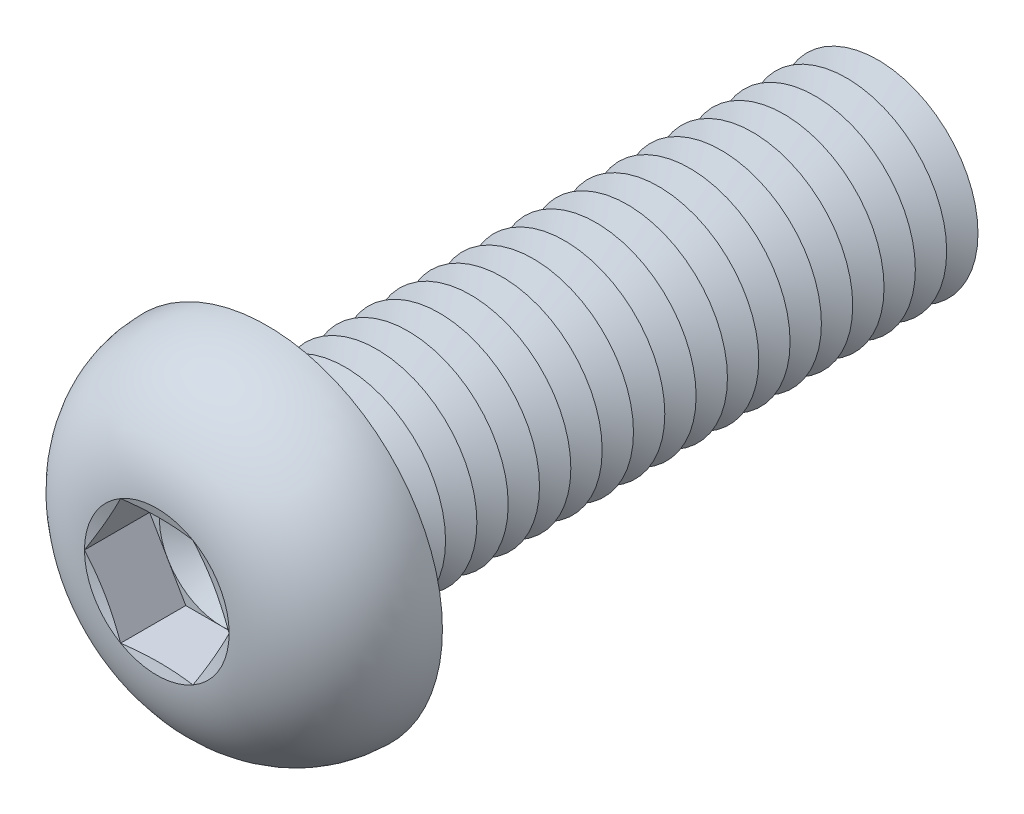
SolidWorks part; units mm, degrees
ref_plane "Front Plane" through (0, 0, 0) normal (0, 0, 1) x (1, 0, 0)
ref_plane "Top Plane" through (0, 0, 0) normal (0, 1, 0) x (1, 0, 0)
ref_plane "Right Plane" through (0, 0, 0) normal (1, 0, 0) x (0, 0, -1)
sketch "Sketch1" plane through (0, 0, 0) normal (1, 0, 0) x (0, 0, -1)
  line L0 (0, 4) -> (0, 7)
  line L3 (0, 4) -> (25, 4)
  line L4 (25, 4) -> (25, 0)
  line L5 (25, 0) -> (-4.4, 0) construction
  line L6 (-4.4, 0) -> (25, 0)
  line L7 (-4.4, 2.8867) -> (-4.4, 1.4434) construction
  line L8 (-4.4, 1.4434) -> (-4.4, 0)
  line L9 (-4.4, 2.8867) -> (-4.0132, 1.4434)
  line L10 (-4.0132, 1.4434) -> (-4.4, 1.4434)
  line L11 (25, 0) -> (22.7481, 0) construction
  line L12 (0, 7) -> (-4.4, 7) construction
  arc A1 (0, 7) -> (-4.4, 2.8867) centre (0, 2.59) ccw
  point P8 (25, 2)
  dimension "D1" = 14
  dimension "D2" = 8
  dimension "D3" = 4.4
  dimension "D4" = 5.7735
  dimension "D5" = 25
  dimension "D6" = 15
revolve "Revolve1" add sketch "Sketch1" angle 360 about L5
fillet "Fillet1" radius 0.625 1 edges at (-4, 0, 0)
sketch "Sketch2" plane through (0, 0, 0) normal (1, 0, 0) x (0, 0, -1)
  line L0 (24.375, 4) -> (25.625, 4)
  line L1 (25, 4) -> (0.625, 4) construction
  line L2 (25.625, 4) -> (25, 2.9175)
  line L3 (25, -4) -> (25, 4) construction
  line L4 (25, 2.9175) -> (24.375, 4)
  dimension "D1" = 1.25
revolve "Cut-Revolve1" cut sketch "Sketch2" angle 360 about axis through (0, 0, -25) along (0, 0, -1)
pattern_linear "LPattern1" count 20 spacing 1.25 along (0, 0, 1) of "Cut-Revolve1"
sketch "Sketch3" plane through (0, 0, 4.4) normal (0, 0, 1) x (1, 0, 0)
  line L7 (1.4434, 2.5) -> (-1.4434, 2.5)
  line L8 (-1.4434, 2.5) -> (-2.8867, 0)
  line L9 (-2.8867, 0) -> (-1.4434, -2.5)
  line L10 (-1.4434, -2.5) -> (1.4434, -2.5)
  line L11 (1.4434, -2.5) -> (2.8867, 0)
  line L12 (2.8867, 0) -> (1.4434, 2.5)
  circle A0 centre (0, 0) radius 2.5 construction
  circle A3 centre (0, 0) radius 2.8867 construction
extrude "Cut-Extrude1" cut sketch "Sketch3" against normal blind 2.6
sketch "Sketch4" plane through (0, 0, 1.8) normal (0, 0, 1) x (1, 0, 0)
  line L1 (1.4434, 2.5) -> (-1.4434, 2.5) construction
  circle A0 centre (0, 0) radius 2.5
extrude "Cut-Extrude2" cut sketch "Sketch4" against normal through all draft 60
